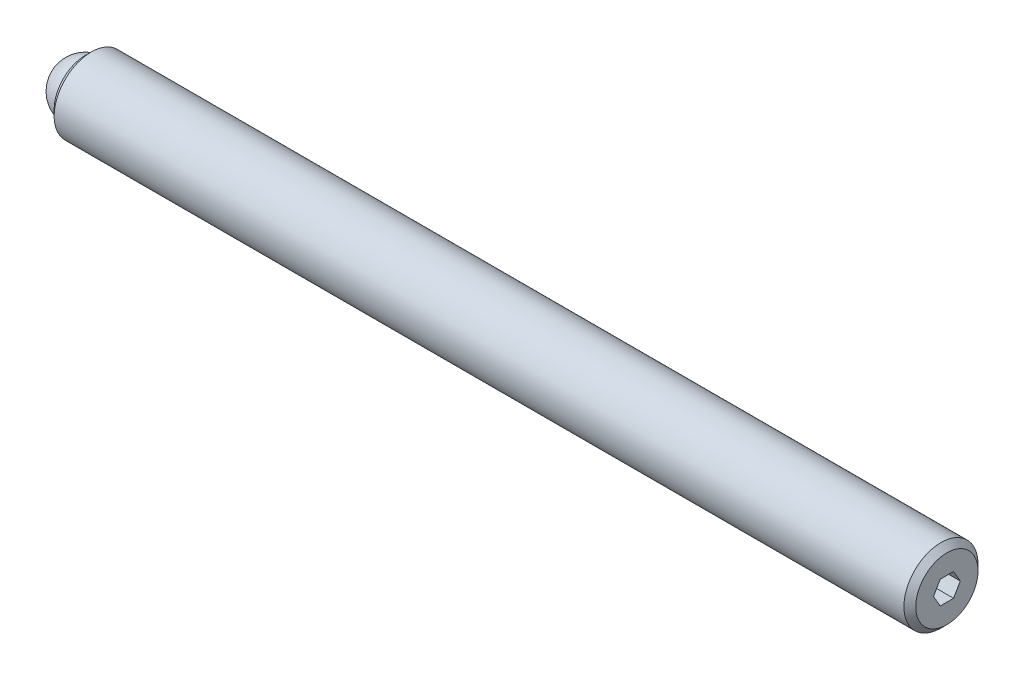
SolidWorks part; units mm, degrees
ref_plane "Front Plane" through (0, 0, 0) normal (0, 0, 1) x (1, 0, 0)
ref_plane "Top Plane" through (0, 0, 0) normal (0, 1, 0) x (1, 0, 0)
ref_plane "Right Plane" through (0, 0, 0) normal (1, 0, 0) x (0, 0, -1)
sketch "Sketch2" plane through (0, 0, 0) normal (1, 0, 0) x (0, 0, -1)
  circle A0 centre (0, 0) radius 3.175
  dimension "D1" = 6.35
extrude "Boss-Extrude1" add sketch "Sketch2" along normal blind 73.8188
sketch "Sketch3" plane through (0, 0, 0) normal (-1, 0, 0) x (0, 0, 1)
  circle A0 centre (0, 0) radius 2.3813
  dimension "D1" = 4.7625
chamfer "Chamfer1" distance 0.508 angle 45 1 edges at (0, 0, -3.175)
chamfer "Chamfer2" distance 0.508 angle 45 1 edges at (73.8188, 0, -3.175)
sketch "Sketch4" plane through (73.8188, 0, 0) normal (1, 0, 0) x (0, 0, -1)
  line L1 (1.1457, 0) -> (0.5728, 0.9922)
  line L2 (0.5728, 0.9922) -> (-0.5728, 0.9922)
  line L3 (-0.5728, 0.9922) -> (-1.1457, 0)
  line L4 (-1.1457, 0) -> (-0.5728, -0.9922)
  line L5 (-0.5728, -0.9922) -> (0.5728, -0.9922)
  line L6 (0.5728, -0.9922) -> (1.1457, 0)
  circle A0 centre (0, 0) radius 0.9922 construction
  dimension "D1" = 1.9844
extrude "Cut-Extrude2" cut sketch "Sketch4" against normal blind 2.286
extrude "Cut-Extrude3" cut sketch "Sketch3" against normal blind 1.9844
sketch "Sketch5" plane through (0, 0, 0) normal (-1, 0, 0) x (0, 0, 1)
  line L0 (0, 0) -> (0, -2.3813)
  line L1 (0, 0) -> (0, 2.3813)
  arc A0 (0, 2.3813) -> (0, -2.3813) centre (0, 0) ccw
  dimension "D1" = 2.3813
revolve "Revolve1" add sketch "Sketch5" angle 360 about L1
